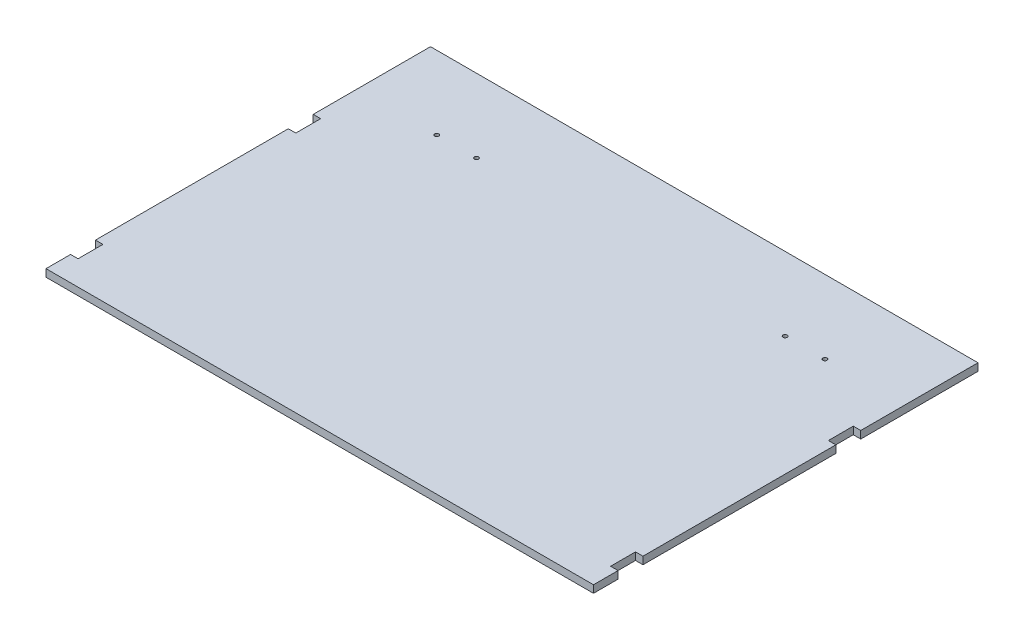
SolidWorks part; units mm, degrees
ref_plane "Ebene vorne" through (0, 0, 0) normal (0, 0, 1) x (1, 0, 0)
ref_plane "Ebene oben" through (0, 0, 0) normal (0, 1, 0) x (1, 0, 0)
ref_plane "Ebene rechts" through (0, 0, 0) normal (1, 0, 0) x (0, 0, -1)
sketch "Skizze1" plane through (0, 0, 0) normal (0, 1, 0) x (1, 0, 0)
  line L0 (0, 169.8464) -> (0, -171.9327) construction
  line L1 (-238.144, 0) -> (238.144, 0) construction
  line L2 (220, 40.25) -> (220, -114.75)
  line L3 (-220, 154.5) -> (220, 154.5)
  line L4 (-220, 154.5) -> (-220, 60.25)
  line L5 (-220, -154.5) -> (220, -154.5)
  line L6 (220, 154.5) -> (220, 60.25)
  line L7 (220, 60.25) -> (214, 60.25)
  line L8 (220, -134.75) -> (220, -154.5)
  line L9 (220, 40.25) -> (214, 40.25)
  line L10 (214, 60.25) -> (214, 40.25)
  line L11 (220, -114.75) -> (214, -114.75)
  line L12 (-214, -114.75) -> (-214, -134.75)
  line L13 (220, -134.75) -> (214, -134.75)
  line L14 (214, -114.75) -> (214, -134.75)
  line L15 (-220, -134.75) -> (-214, -134.75)
  line L16 (-220, -114.75) -> (-214, -114.75)
  line L17 (-214, 60.25) -> (-214, 40.25)
  line L18 (-220, 40.25) -> (-214, 40.25)
  line L19 (-220, 60.25) -> (-214, 60.25)
  line L20 (-220, 40.25) -> (-220, -114.75)
  line L21 (-220, -134.75) -> (-220, -154.5)
  line L22 (-140, 173.1485) -> (-140, 115.4061) construction
  line L23 (-182.7646, 95.5) -> (-107.0404, 95.5) construction
  circle A0 centre (-156, 95.5) radius 1.65
  circle A1 centre (-124, 95.5) radius 1.65
  circle A2 centre (156, 95.5) radius 1.65
  circle A3 centre (124, 95.5) radius 1.65
  dimension "D9" = 3.3
  dimension "D1" = 440
  dimension "D2" = 309
  dimension "D3" = 6
  dimension "D4" = 94.25
  dimension "D5" = 20
  dimension "D6" = 20
  dimension "D7" = 155
  dimension "D8" = 32
  dimension "D10" = 59
  dimension "D11" = 80
extrude "Aufsatz-Linear austragen1" add sketch "Skizze1" along normal blind 6
